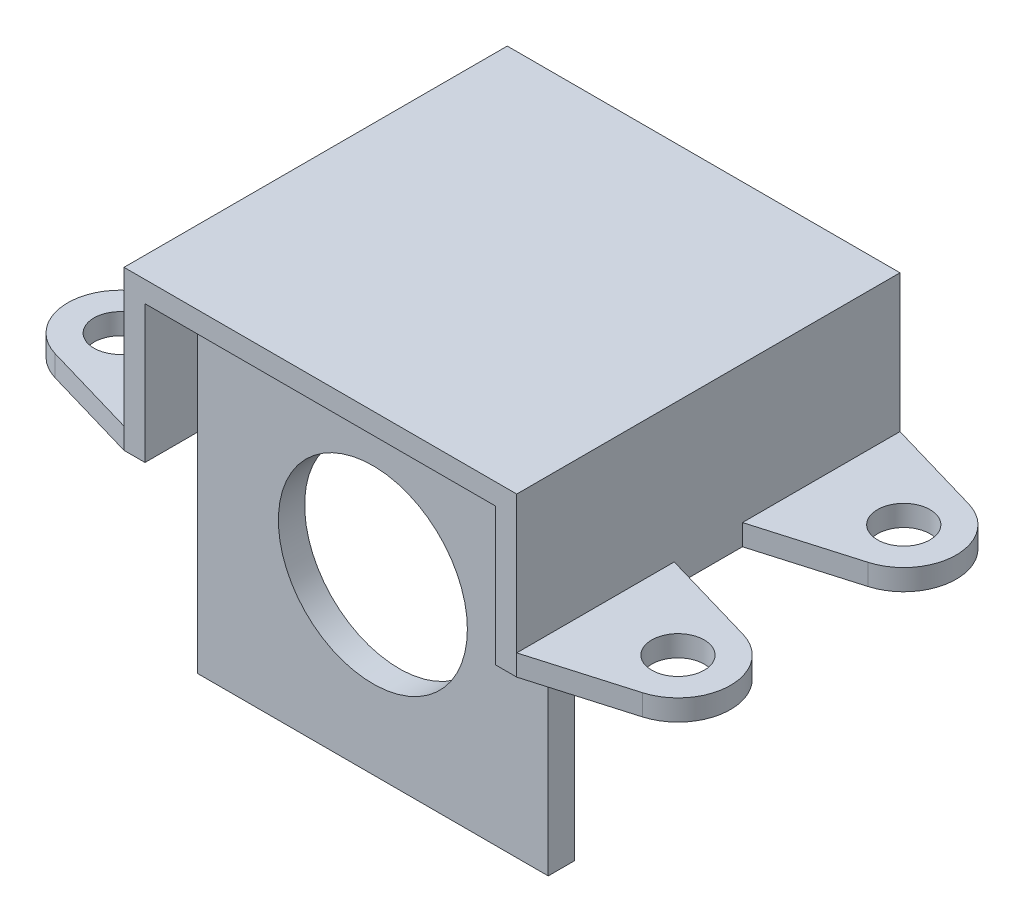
SolidWorks part; units mm, degrees
ref_plane "Front Plane" through (0, 0, 0) normal (0, 0, 1) x (1, 0, 0)
ref_plane "Top Plane" through (0, 0, 0) normal (0, 1, 0) x (1, 0, 0)
ref_plane "Right Plane" through (0, 0, 0) normal (1, 0, 0) x (0, 0, -1)
sketch "Sketch1" plane through (0, 0, 0) normal (0, 0, 1) x (1, 0, 0)
  line L1 (-26.592, 13.5411) -> (15.826, 13.5411)
  line L2 (-26.592, 13.5411) -> (-26.592, -28.3689)
  line L3 (-26.592, -28.3689) -> (15.826, -28.3689)
  line L4 (15.826, 13.5411) -> (15.826, -28.3689)
  circle A0 centre (-5.383, -7.4139) radius 11.43
extrude "Boss-Extrude1" add sketch "Sketch1" along normal blind 3.175
sketch "Sketch2" plane through (0, 13.5411, 0) normal (0, 1, 0) x (1, 0, 0)
  line L0 (15.826, -3.175) -> (-26.592, -3.175) construction
  line L1 (-26.592, -9.525) -> (15.826, -9.525)
  line L2 (-26.592, -9.525) -> (-26.592, 36.83)
  line L3 (-26.592, 36.83) -> (15.826, 36.83)
  line L4 (15.826, -9.525) -> (15.826, 36.83)
  dimension "D1" = 42.418
  dimension "D2" = 6.35
  dimension "D3" = 46.355
extrude "Boss-Extrude2" add sketch "Sketch2" along normal blind 2.54
sketch "Sketch3" plane through (15.826, 0, 0) normal (1, 0, 0) x (0, 0, -1)
  line L1 (-9.525, 16.0811) -> (36.83, 16.0811)
  line L2 (-9.525, 16.0811) -> (-9.525, -3.0959)
  line L3 (-9.525, -3.0959) -> (36.83, -3.0959)
  line L4 (36.83, 16.0811) -> (36.83, -3.0959)
  dimension "D1" = 19.177
  dimension "D2" = 46.355
extrude "Boss-Extrude3" add sketch "Sketch3" along normal blind 2.54
sketch "Sketch4" plane through (0, -3.0959, 0) normal (0, -1, 0) x (1, 0, 0)
  line L0 (18.366, 9.525) -> (18.366, -36.83) construction
  line L2 (18.366, -36.83) -> (30.1257, -33.401)
  line L3 (18.366, -27.305) -> (18.366, -36.83)
  line L4 (18.366, -27.305) -> (18.366, -17.78)
  line L5 (18.366, 9.525) -> (30.1257, 6.0961)
  line L6 (18.366, -9.525) -> (30.1257, -6.0961)
  line L7 (18.366, -17.78) -> (30.1257, -21.209)
  line L8 (18.366, 0) -> (18.366, 9.525)
  line L9 (18.366, 0) -> (18.366, -9.525)
  circle A0 centre (28.3482, 0) radius 3.175
  circle A1 centre (28.3482, -27.305) radius 3.175
  arc A3 (30.1257, -21.209) -> (30.1257, -33.401) centre (28.3482, -27.305) cw
  arc A4 (30.1257, 6.0961) -> (30.1257, -6.0961) centre (28.3482, 0) cw
  dimension "D1" = 6.35
  dimension "D4" = 9.525
  dimension "D3" = 9.9822
  dimension "D5" = 9.525
  dimension "D6" = 9.525
  dimension "D7" = 9.525
extrude "Boss-Extrude4" add sketch "Sketch4" against normal blind 2.54
ref_plane "Plane1" through (-5.383, 0, 0) normal (-1, 0, 0) x (0, 0, 1)
mirror "Mirror1" about plane through (-5.383, 0, 0) normal (-1, 0, 0) of "Boss-Extrude3", "Boss-Extrude4"
sketch "Sketch5" plane through (0, 0, -36.83) normal (0, 0, -1) x (-1, 0, 0)
  line L1 (-15.826, 13.5411) -> (26.592, 13.5411)
  line L2 (-15.826, 13.5411) -> (-15.826, -3.0959)
  line L3 (-15.826, -3.0959) -> (26.592, -3.0959)
  line L4 (26.592, 13.5411) -> (26.592, -3.0959)
extrude "Boss-Extrude5" add sketch "Sketch5" against normal blind 2.54
equation "\"D4@Sketch1\"=\"D1@Sketch1\"/2"
equation "\"D5@Sketch1\"=\"D2@Sketch1\"/2"
